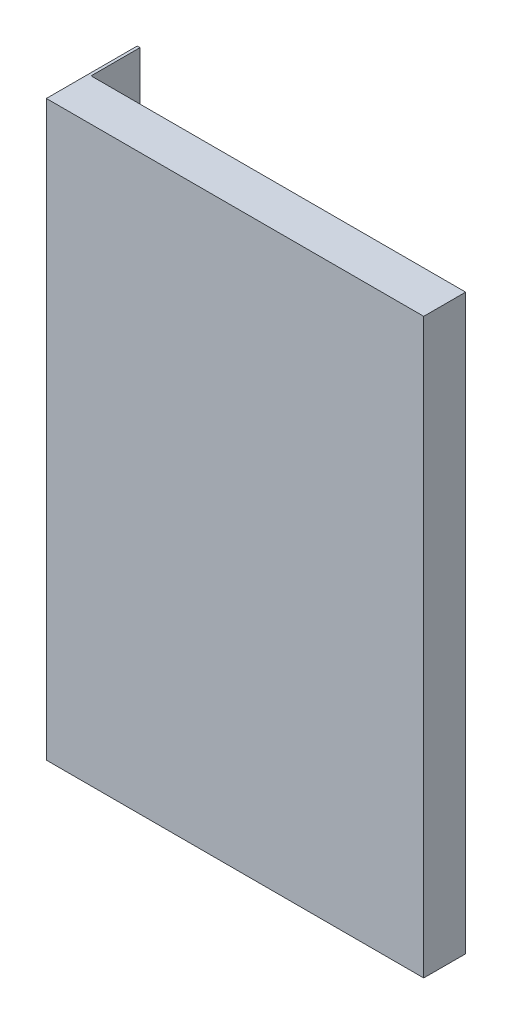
SolidWorks part; units mm, degrees
ref_plane "Plan de face" through (0, 0, 0) normal (0, 0, 1) x (1, 0, 0)
ref_plane "Plan de dessus" through (0, 0, 0) normal (0, 1, 0) x (1, 0, 0)
ref_plane "Plan de droite" through (0, 0, 0) normal (1, 0, 0) x (0, 0, -1)
sketch "Esquisse1" plane through (0, 0, 0) normal (0, 0, 1) x (1, 0, 0)
  line L0 (-21, 18) -> (7.5, 18) construction
  line L1 (-6, -1) -> (-16, -1)
  line L2 (-6, -1) -> (-6, -11)
  line L3 (-6, -11) -> (-16, -11)
  line L4 (-16, -1) -> (-16, -11)
  line L5 (0, 0) -> (0, -18.5) construction
  dimension "D1" = 19
  dimension "D2" = 6
  dimension "D3" = 10
  dimension "D4" = 10
extrude "Extrusion1" add sketch "Esquisse1" along normal blind 3.5
sketch "Esquisse2" plane through (0, 0, 3.5) normal (0, 0, 1) x (1, 0, 0)
  line L0 (-23, -41.5) -> (-23, 16) construction
  line L1 (-23, 15.5) -> (4, 15.5)
  line L2 (-23, 15.5) -> (-23, -25.5)
  line L3 (-23, -25.5) -> (4, -25.5)
  line L4 (4, 15.5) -> (4, -25.5)
  line L5 (-21, 18) -> (7.5, 18) construction
  dimension "D1" = 41
  dimension "D2" = 27
  dimension "D3" = 2.5
extrude "Extrusion2" add sketch "Esquisse2" along normal blind 3
sketch "Esquisse3" plane through (-23, 0, 0) normal (-1, 0, 0) x (0, 0, 1)
  line L0 (0, -41.5) -> (0, 16) construction
  line L1 (3.5, 15.5) -> (0, 15.5)
  line L2 (3.5, 15.5) -> (3.5, -25.5)
  line L3 (3.5, -25.5) -> (0, -25.5)
  line L4 (0, 15.5) -> (0, -25.5)
  line L5 (6.5, -25.5) -> (3.5, -25.5) construction
extrude "Extrusion3" add sketch "Esquisse3" against normal blind 0.2
